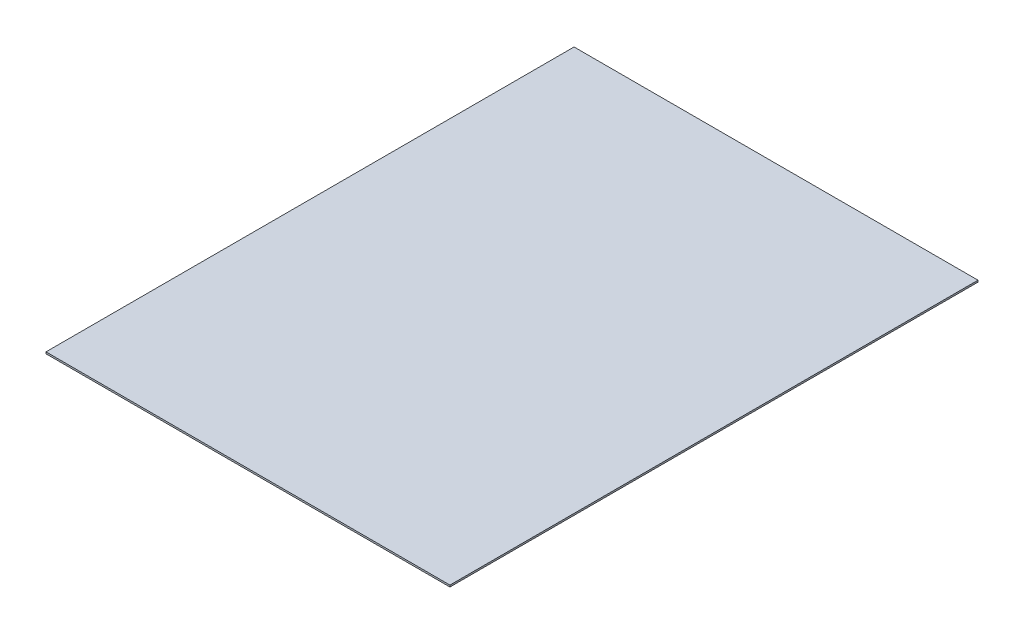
SolidWorks part; units mm, degrees
ref_plane "Vorderseite" through (0, 0, 0) normal (0, 0, 1) x (1, 0, 0)
ref_plane "Oben" through (0, 0, 0) normal (0, 1, 0) x (1, 0, 0)
ref_plane "Rechts" through (0, 0, 0) normal (1, 0, 0) x (0, 0, -1)
sketch "Skizze1" plane through (0, 0, 0) normal (0, 1, 0) x (1, 0, 0)
  line L0 (1000, -1500) -> (1000, 5000) construction
  line L1 (1000, 5000) -> (6000, 5000) construction
  line L2 (6000, -618.3651) -> (1000, -1500) construction
  line L3 (6000, -618.3651) -> (6000, 5000) construction
  line L4 (0, -50) -> (0, 50) construction
  line L5 (-50, 0) -> (50, 0) construction
  line L7 (-5900.2716, -13001.9167) -> (17626.7812, -13001.9167)
  line L8 (-5900.2716, -13001.9167) -> (-5900.2716, 17755.081)
  line L9 (-5900.2716, 17755.081) -> (17626.7812, 17755.081)
  line L10 (17626.7812, -13001.9167) -> (17626.7812, 17755.081)
  dimension "D1" = 1000
  dimension "D2" = 5000
  dimension "D3" = 5000
  dimension "D4" = 10
  dimension "D5" = 1500
  dimension "D6" = 23527.0527
  dimension "D7" = 30756.9978
extrude "Aufsatz-Linear austragen1" add sketch "Skizze1" against normal blind 100
